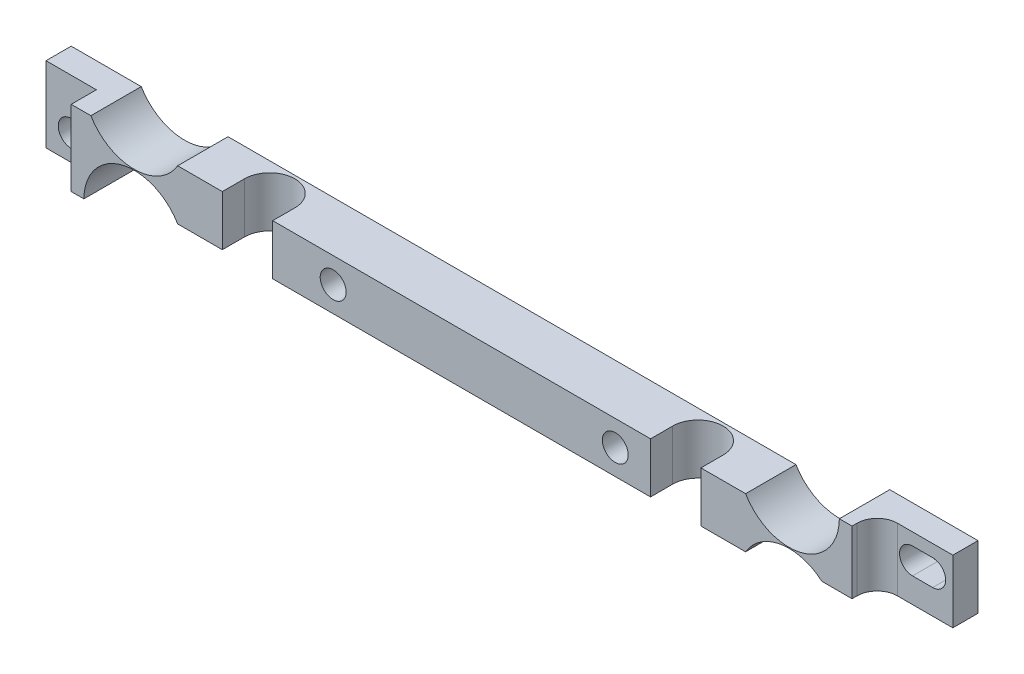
SolidWorks part; units mm, degrees
ref_plane "Front Plane" through (0, 0, 0) normal (0, 0, 1) x (1, 0, 0)
ref_plane "Top Plane" through (0, 0, 0) normal (0, 1, 0) x (1, 0, 0)
ref_plane "Right Plane" through (0, 0, 0) normal (1, 0, 0) x (0, 0, -1)
sketch "Sketch1" plane through (0, 0, 0) normal (0, 0, 1) x (1, 0, 0)
  line L0 (0, 6.35) -> (114.3, 6.35) construction
  line L1 (0, 0) -> (6.35, 0)
  line L2 (0, 0) -> (0, 9.525)
  line L3 (0, 9.525) -> (6.35, 9.525)
  line L4 (6.35, 0) -> (6.35, 9.525)
  line L5 (7.9375, 0) -> (7.9504, 0)
  line L6 (6.35, 0) -> (7.9375, 0)
  line L7 (6.35, 0) -> (6.35, 9.525)
  line L8 (6.35, 9.525) -> (7.9375, 9.525)
  line L9 (7.9375, 0) -> (7.9375, 9.525)
  line L10 (114.3, 12.7) -> (107.95, 12.7)
  line L11 (114.3, 12.7) -> (114.3, 3.175)
  line L12 (114.3, 3.175) -> (107.95, 3.175)
  line L13 (107.95, 12.7) -> (107.95, 3.175)
  line L14 (107.95, 12.7) -> (103.1748, 12.7)
  line L15 (107.95, 12.7) -> (107.95, 3.175)
  line L16 (107.95, 3.175) -> (103.1748, 3.175)
  line L17 (103.1748, 12.7) -> (103.1748, 3.175)
  line L18 (103.1748, 3.175) -> (7.9375, 3.175)
  line L19 (103.1748, 3.175) -> (103.1748, 9.525)
  line L20 (103.1748, 9.525) -> (7.9375, 9.525)
  line L21 (7.9375, 3.175) -> (7.9375, 9.525)
  line L22 (7.9504, 0) -> (9.5258, 0)
  line L23 (103.1748, 12.7) -> (101.5992, 12.7)
  line L25 (111.125, 11.157) -> (111.76, 11.1569)
  line L26 (111.125, 11.157) -> (111.125, 7.893)
  line L27 (111.125, 7.893) -> (111.76, 7.893)
  line L28 (111.76, 11.1569) -> (111.76, 7.893)
  line L29 (111.125, 11.157) -> (109.22, 11.1569)
  line L30 (111.125, 11.157) -> (111.125, 7.893)
  line L31 (111.125, 7.893) -> (109.22, 7.893)
  line L32 (109.22, 11.1569) -> (109.22, 7.893)
  circle A0 centre (3.175, 3.175) radius 1.632
  circle A1 centre (14.3002, -0.0508) radius 6.35
  circle A2 centre (14.3002, 12.7508) radius 6.35
  circle A3 centre (111.125, 9.525) radius 1.632
  circle A4 centre (96.8248, 12.7508) radius 6.35
  circle A5 centre (96.8248, -0.0508) radius 6.35
  circle A6 centre (111.76, 9.525) radius 1.632
  circle A7 centre (109.22, 9.525) radius 1.632
  dimension "D3" = 3.2639
  dimension "D11" = 12.7
  dimension "D12" = 12.7
  dimension "D20" = 3.2639
  dimension "D24" = 12.7
  dimension "D25" = 12.7
  dimension "D1" = 9.525
  dimension "D2" = 6.35
  dimension "D4" = 3.175
  dimension "D5" = 3.175
  dimension "D6" = 114.3
  dimension "D7" = 6.35
  dimension "D8" = 3.175
  dimension "D9" = 6.35
  dimension "D10" = 1.5875
  dimension "D13" = 11.1252
  dimension "D14" = 11.1252
  dimension "D15" = 6.4008
  dimension "D16" = 6.4008
  dimension "D17" = 6.35
  dimension "D18" = 6.35
  dimension "D19" = 3.175
  dimension "D21" = 3.175
  dimension "D22" = 3.175
  dimension "D23" = 4.7752
  dimension "D26" = 6.4008
  dimension "D27" = 6.4008
  dimension "D28" = 6.35
  dimension "D29" = 6.35
  dimension "D30" = 0.635
  dimension "D31" = 1.905
extrude "Extrude1" add sketch "Sketch1" along normal blind 6.35 contours L0 L4 L3 L2 | L7 L0 L2 L1 A0 | L21 L0 L7 L6 L9 | L0 L9 L8 L4 | L5 A1 L18 L9 | L0 L19 L20 A4 A2 L9 | L17 L0 L21 L18 A1 A5 | L23 A4 L20 L17 | L0 L15 L14 L17 L19 | L0 L11 L10 L15 A3 | L13 L0 L17 L16 | L11 L0 L13 L12
sketch "Sketch5" plane through (0, 0, 0) normal (0, 0, -1) x (-1, 0, 0)
  line L1 (-114.3, 3.175) -> (-98.3133, 3.175)
  line L2 (-114.3, 3.175) -> (-114.3, 4.7625)
  line L3 (-114.3, 4.7625) -> (-98.3133, 4.7625)
  line L4 (-98.3133, 3.175) -> (-98.3133, 4.7625)
  dimension "D1" = 1.5875
extrude "Cut-Extrude4" cut sketch "Sketch5" against normal through all
sketch "Sketch6" plane through (0, 0, 0) normal (0, -1, 0) x (1, 0, 0)
  line L1 (0, 6.35) -> (6.35, 6.35)
  line L2 (0, 6.35) -> (0, 3.175)
  line L3 (0, 3.175) -> (6.35, 3.175)
  line L4 (6.35, 6.35) -> (6.35, 3.175)
  dimension "D1" = 3.175
  dimension "D2" = 6.35
extrude "Cut-Extrude5" cut sketch "Sketch6" against normal through all
sketch "Sketch7" plane through (0, 4.7625, 0) normal (0, -1, 0) x (1, 0, 0)
  line L1 (114.3, 6.35) -> (104.775, 6.35)
  line L2 (114.3, 6.35) -> (114.3, 3.175)
  line L3 (114.3, 3.175) -> (107.315, 3.175)
  line L4 (104.775, 6.35) -> (104.775, 5.715)
  arc A0 (107.315, 3.175) -> (104.775, 5.715) centre (107.315, 5.715) cw
  dimension "D3" = 2.54
  dimension "D1" = 3.175
  dimension "D2" = 9.525
extrude "Cut-Extrude6" cut sketch "Sketch7" against normal through all
sketch "Sketch8" plane through (0, 3.175, 0) normal (0, -1, 0) x (1, 0, 0)
  line L0 (19.7698, 0) -> (91.3552, 0) construction
  line L1 (19.7698, 6.35) -> (91.3552, 6.35) construction
  line L2 (85.725, 3.556) -> (79.375, 3.556)
  line L3 (85.725, 3.556) -> (85.725, 6.35)
  line L4 (85.725, 6.35) -> (79.375, 6.35)
  line L5 (79.375, 3.556) -> (79.375, 6.35)
  line L7 (31.75, 3.556) -> (25.4, 3.556)
  line L8 (31.75, 3.556) -> (31.75, 6.35)
  line L9 (31.75, 6.35) -> (25.4, 6.35)
  line L10 (25.4, 3.556) -> (25.4, 6.35)
  circle A0 centre (28.575, 3.556) radius 3.175
  circle A1 centre (82.55, 3.556) radius 3.175
  dimension "D1" = 6.35
  dimension "D2" = 6.35
  dimension "D3" = 3.556
  dimension "D4" = 3.556
  dimension "D5" = 28.575
  dimension "D6" = 31.75
extrude "Cut-Extrude7" cut sketch "Sketch8" against normal through all contours L10 A0 M3 | A0 L8 M3 | A0 L9 L7 | A0 L7 | L5 A1 M3 | A1 L4 L2 | A1 L3 M3 | A1 L2
sketch "Sketch9" plane through (0, 0, 6.35) normal (0, 0, 1) x (1, 0, 0)
  line L0 (31.75, 9.525) -> (79.375, 9.525) construction
  line L1 (0, 9.525) -> (0, 0) construction
  line L2 (114.3, 12.7) -> (114.3, 4.7625) construction
  circle A0 centre (39.37, 6.35) radius 1.6319
  circle A1 centre (74.93, 6.35) radius 1.6319
  dimension "D5" = 3.2639
  dimension "D6" = 3.2639
  dimension "D1" = 3.175
  dimension "D2" = 3.175
  dimension "D3" = 39.37
  dimension "D4" = 39.37
extrude "Cut-Extrude8" cut sketch "Sketch9" against normal blind 6.35
